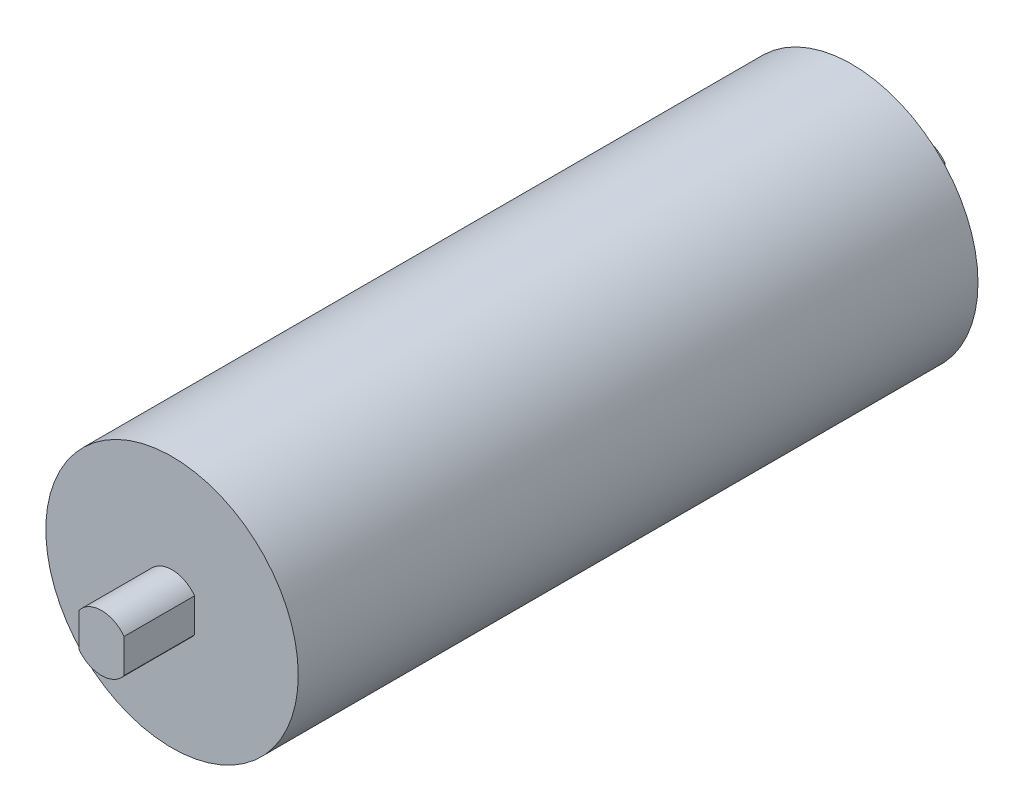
SolidWorks part; units mm, degrees
ref_plane "前视基准面" through (0, 0, 0) normal (0, 0, 1) x (1, 0, 0)
ref_plane "上视基准面" through (0, 0, 0) normal (0, 1, 0) x (1, 0, 0)
ref_plane "右视基准面" through (0, 0, 0) normal (1, 0, 0) x (0, 0, -1)
sketch "草图1" plane through (0, 0, 0) normal (0, 0, 1) x (1, 0, 0)
  circle A0 centre (0, 0) radius 44.75
  dimension "D1" = 89.5
extrude "拉伸1" add sketch "草图1" along normal mid plane 241
sketch "草图2" plane through (0, 0, 120.5) normal (0, 0, 1) x (1, 0, 0)
  circle A0 centre (0, 0) radius 10
  dimension "D1" = 20
extrude "拉伸2" add sketch "草图2" along normal blind 25
sketch "草图3" plane through (0, 0, -120.5) normal (0, 0, -1) x (-1, 0, 0)
  circle A0 centre (0, 0) radius 10
  dimension "D1" = 20
extrude "拉伸3" add sketch "草图3" along normal blind 25
sketch "草图4" plane through (0, 0, 145.5) normal (0, 0, 1) x (1, 0, 0)
  line L0 (-8, 6) -> (-8, -6)
  line L1 (8, 6) -> (8, -6)
  circle A0 centre (0, 0) radius 10 construction
  arc A1 (-8, 6) -> (-8, -6) centre (0, 0) ccw
  arc A2 (8, -6) -> (8, 6) centre (0, 0) ccw
  dimension "D1" = 8
  dimension "D2" = 8
extrude "切除-拉伸1" cut sketch "草图4" against normal blind 25
mirror "镜向1" about plane through (0, 0, 0) normal (0, 0, 1) of "切除-拉伸1"
